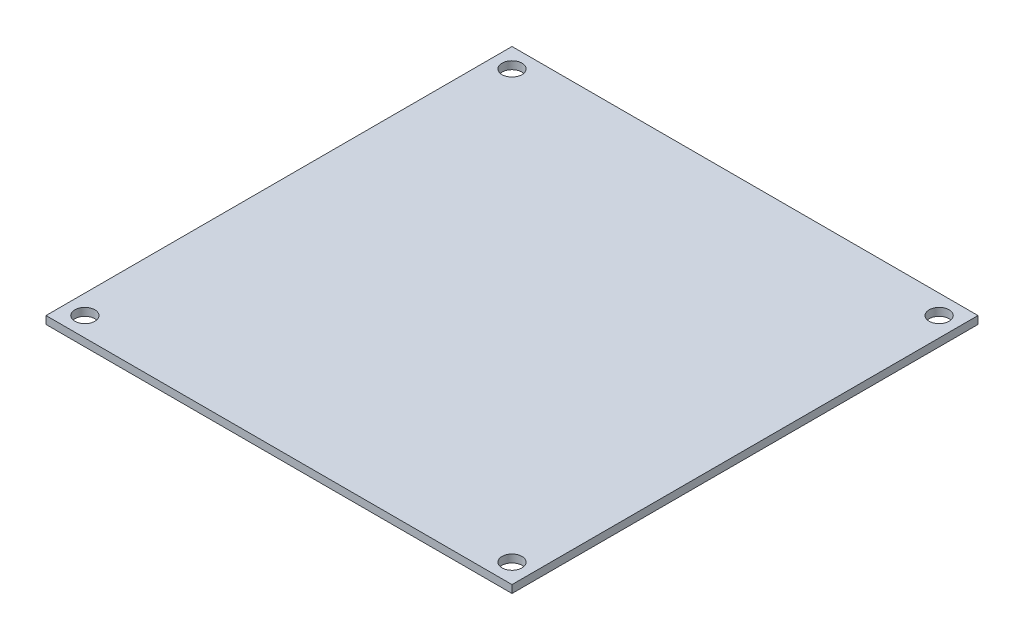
SolidWorks part; units mm, degrees
ref_plane "Front Plane" through (0, 0, 0) normal (0, 0, 1) x (1, 0, 0)
ref_plane "Top Plane" through (0, 0, 0) normal (0, 1, 0) x (1, 0, 0)
ref_plane "Right Plane" through (0, 0, 0) normal (1, 0, 0) x (0, 0, -1)
sketch "Sketch1" plane through (0, 0, 0) normal (0, 1, 0) x (1, 0, 0)
  line L1 (0, 0) -> (76.2, 0)
  line L2 (0, 0) -> (0, 76.2)
  line L3 (0, 76.2) -> (76.2, 76.2)
  line L4 (76.2, 0) -> (76.2, 76.2)
  dimension "D1" = 76.2
  dimension "D2" = 76.2
extrude "Extrude1" add sketch "Sketch1" against normal blind 1.27
hole_wizard "#4 Clearance Hole1" positions "3DSketch1" profile "Sketch2" hole size "#4" standard "Ansi Inch"
sketch3d "3DSketch1"
  circle A0 centre (3.175, -1.27, -73.025) radius 1.524 construction
  circle A1 centre (73.025, -1.27, -73.025) radius 1.524 construction
  circle A2 centre (3.175, -1.27, -3.175) radius 1.524 construction
  circle A3 centre (73.025, -1.27, -3.175) radius 1.524 construction
  point P0 (73.025, 0, -3.175)
  point P2 (3.175, 0, -73.025)
  point P4 (3.175, 0, -3.175)
  point P6 (73.025, 0, -73.025)
  point P11 (3.175, 0.254, -73.025)
  point P14 (73.025, 0.254, -73.025)
  point P18 (3.175, 0.254, -3.175)
  point P21 (73.025, 0.254, -3.175)
sketch "Sketch2" plane through (73.025, 0, -3.175) normal (1, 0, 0) x (0, 0, 1)
  line L0 (0, 0) -> (0, 10.1246)
  line L1 (0, 10.1246) -> (1.6319, 9.144)
  line L2 (1.6319, 9.144) -> (1.6319, 0)
  line L5 (1.6319, 0) -> (0, 0)
  line L10 (0, 10.1246) -> (-1.632, 9.144) construction
  line L11 (0, -6.35) -> (0, 107.95) construction
  dimension "Hole Dia." = 3.2639
  dimension "Hole Depth" = 9.144
  dimension "Drill Angle" = 118
